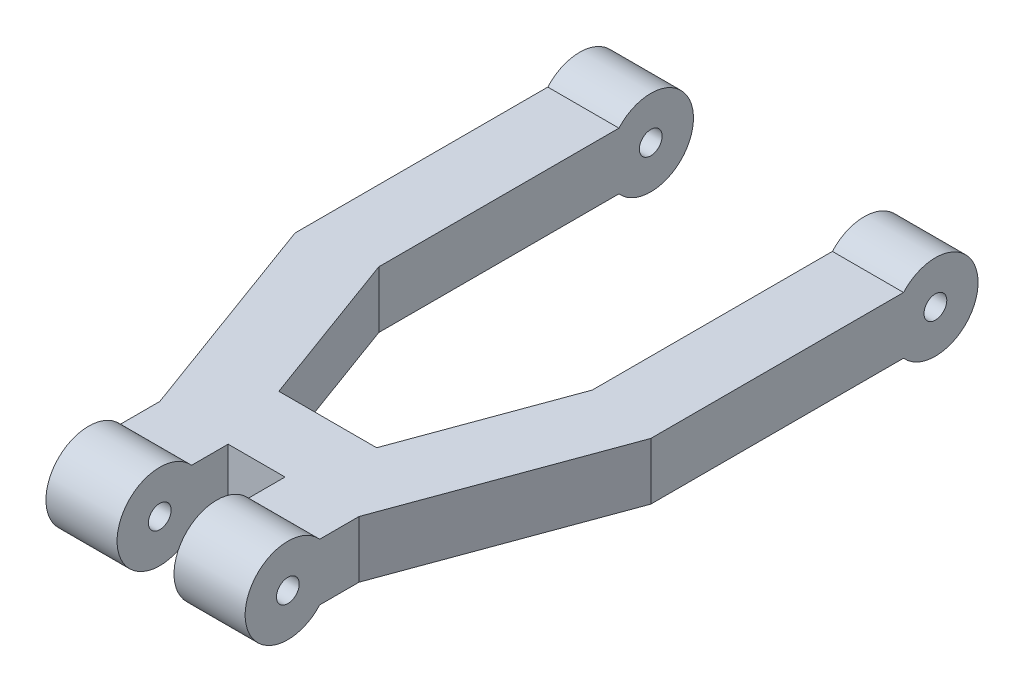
SolidWorks part; units mm, degrees
ref_plane "Front Plane" through (0, 0, 0) normal (0, 0, 1) x (1, 0, 0)
ref_plane "Top Plane" through (0, 0, 0) normal (0, 1, 0) x (1, 0, 0)
ref_plane "Right Plane" through (0, 0, 0) normal (1, 0, 0) x (0, 0, -1)
sketch "Sketch1" plane through (0, 0, 0) normal (1, 0, 0) x (0, 0, -1)
  line L1 (0, 0) -> (50.8, 0)
  line L2 (0, 0) -> (0, 5.08)
  line L3 (0, 5.08) -> (50.8, 5.08)
  line L4 (50.8, 0) -> (50.8, 5.08)
  dimension "D1" = 5.08
  dimension "D2" = 50.8
extrude "Boss-Extrude1" add sketch "Sketch1" along normal blind 31.75
sketch "Sketch2" plane through (31.75, 0, 0) normal (1, 0, 0) x (0, 0, -1)
  line L0 (0, 5.08) -> (0, 0) construction
  line L1 (50.8, 0) -> (50.8, 5.08) construction
  circle A0 centre (0, 2.54) radius 3.81
  circle A1 centre (50.8, 2.54) radius 3.81
  dimension "D1" = 7.62
  dimension "D2" = 7.62
extrude "Boss-Extrude2" add sketch "Sketch2" against normal blind 31.75
sketch "Sketch3" plane through (0, 5.08, 0) normal (0, 1, 0) x (1, 0, 0)
  line L0 (0, 25.4) -> (6.985, 6.35)
  line L1 (0, 47.9602) -> (0, 2.8398) construction
  line L2 (6.985, 6.35) -> (6.985, -6.1726)
  line L3 (6.985, -6.1726) -> (-2.6073, -6.1726)
  line L4 (-2.6073, -6.1726) -> (-2.6073, 25.4)
  line L5 (-2.6073, 25.4) -> (0, 25.4)
  line L6 (15.875, -8.3954) -> (15.875, 60.0398) construction
  line L7 (6.35, 57.9101) -> (6.35, 26.5275)
  line L8 (6.35, 26.5275) -> (11.5119, 12.4494)
  line L9 (11.5119, 12.4494) -> (20.2381, 12.4494)
  line L10 (6.35, 57.9101) -> (25.4, 57.9101)
  line L11 (25.4, 57.9101) -> (25.4, 26.5275)
  line L12 (25.4, 26.5275) -> (20.2381, 12.4494)
  line L13 (34.3573, -6.1726) -> (34.3573, 25.4)
  line L14 (24.765, -6.1726) -> (34.3573, -6.1726)
  line L15 (24.765, 6.35) -> (24.765, -6.1726)
  line L16 (31.75, 25.4) -> (24.765, 6.35)
  line L17 (34.3573, 25.4) -> (31.75, 25.4)
  line L19 (13.335, 6.0994) -> (18.415, 6.0994)
  line L20 (13.335, 6.0994) -> (13.335, -7.5618)
  line L21 (13.335, -7.5618) -> (18.415, -7.5618)
  line L22 (18.415, 6.0994) -> (18.415, -7.5618)
  line L23 (13.335, 6.0994) -> (18.415, -7.5618) construction
  line L24 (13.335, -7.5618) -> (18.415, 6.0994) construction
  point P15 (15.875, 57.9101)
  point P17 (15.875, 12.4494)
  point P22 (15.875, -0.7312)
  dimension "D1" = 19.05
  dimension "D2" = 8.89
  dimension "D3" = 6.35
  dimension "D4" = 6.35
  dimension "D5" = 5.08
  dimension "D6" = 6.35
extrude "Cut-Extrude1" cut sketch "Sketch3" against normal through all both and the other way through all
sketch "Sketch4" plane through (0, 0, 0) normal (-1, 0, 0) x (0, 0, 1)
  circle A0 centre (-50.8, 2.54) radius 1.016
  circle A1 centre (0, 2.54) radius 1.016
  dimension "D1" = 2.032
  dimension "D2" = 2.032
extrude "Cut-Extrude2" cut sketch "Sketch4" against normal through all
